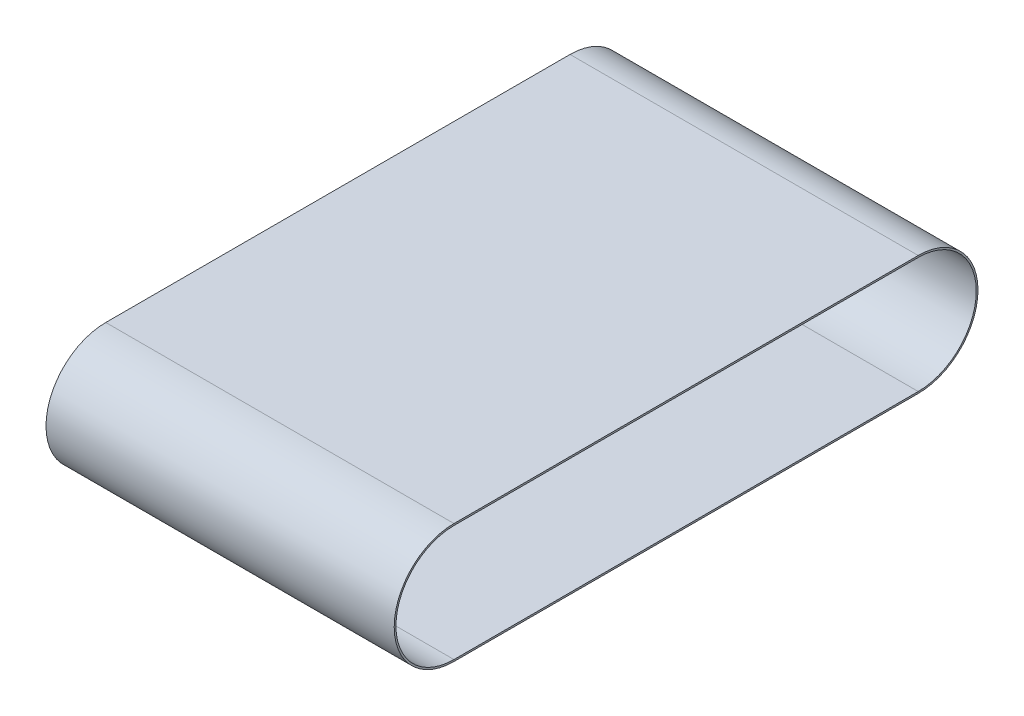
SolidWorks part; units mm, degrees
ref_plane "Front Plane" through (0, 0, 0) normal (0, 0, 1) x (1, 0, 0)
ref_plane "Top Plane" through (0, 0, 0) normal (0, 1, 0) x (1, 0, 0)
ref_plane "Right Plane" through (0, 0, 0) normal (1, 0, 0) x (0, 0, -1)
sketch "Sketch1" plane through (0, 0, 0) normal (1, 0, 0) x (0, 0, -1)
  line L0 (0, 0) -> (800, 0) construction
  line L1 (0, 100) -> (800, 100)
  line L2 (0, -100) -> (800, -100)
  line L3 (0, 103) -> (800, 103)
  line L4 (0, -103) -> (800, -103)
  arc A0 (0, 100) -> (0, -100) centre (0, 0) ccw
  arc A1 (800, -100) -> (800, 100) centre (800, 0) ccw
  arc A2 (800, -103) -> (800, 103) centre (800, 0) ccw
  arc A3 (0, 103) -> (0, -103) centre (0, 0) ccw
  point P3 (400, 0)
  dimension "D2" = 100
  dimension "D1" = 800
  dimension "D3" = 3
extrude "Boss-Extrude1" add sketch "Sketch1" along normal mid plane 600
